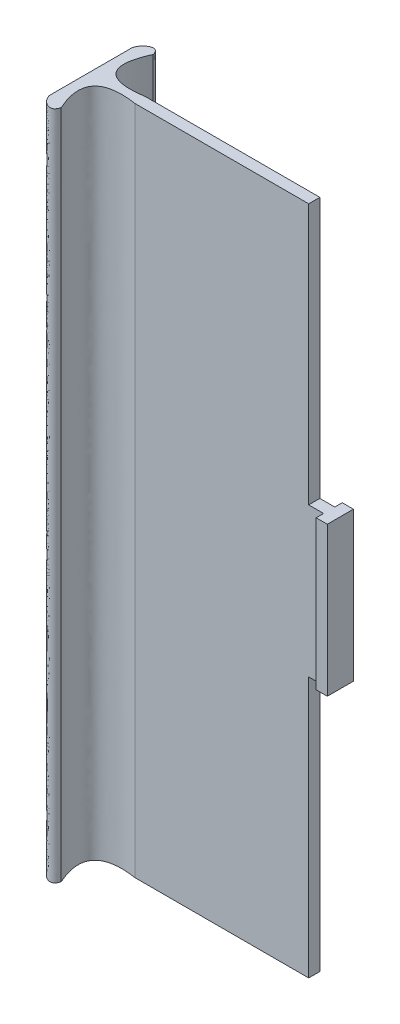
SolidWorks part; units mm, degrees
ref_plane "Front Plane" through (0, 0, 0) normal (0, 0, 1) x (1, 0, 0)
ref_plane "Top Plane" through (0, 0, 0) normal (0, 1, 0) x (1, 0, 0)
ref_plane "Right Plane" through (0, 0, 0) normal (1, 0, 0) x (0, 0, -1)
sketch "Sketch1" plane through (0, 0, 0) normal (0, 1, 0) x (1, 0, 0)
  line L0 (0, 0) -> (0, -3)
  line L1 (0, -1.5) -> (-60, -1.5) construction
  line L2 (-60, -12.043) -> (-60, 9.043)
  line L3 (0, -3) -> (-46.6473, -3)
  line L4 (0, 0) -> (-46.6473, 0)
  spline S0 degree 2 poles (-46.6473, 0) (-61.4881, -2.2557) (-55.5989, 10.8556) knots 0 0 0 1 1 1
  spline S1 degree 3 poles (-55.5989, 10.8556) (-56.3573, 14.2235) (-60.2312, 11.2167) (-60, 9.043) knots 0 0 0 0 1 1 1 1
  spline S2 degree 3 poles (-55.5989, -13.8556) (-56.3573, -17.2235) (-60.2312, -14.2167) (-60, -12.043) knots 0 0 0 0 1 1 1 1
  spline S3 degree 2 poles (-46.6473, -3) (-61.4881, -0.7443) (-55.5989, -13.8556) knots 0 0 0 1 1 1
  point P17 (-56.6355, 1.3857)
  point P18 (-46.6473, 0)
  point P19 (-56.5412, 1.9039)
  point P20 (-54.3269, 10.9499)
  point P21 (-56.9653, 12.3633)
  point P22 (-55.5989, 10.8556)
extrude "Boss-Extrude1" add sketch "Sketch1" along normal blind 180
sketch "Sketch2" plane through (0, 0, 0) normal (0, 0, 1) x (1, 0, 0)
  line L0 (-27.6986, 0) -> (-27.6986, 90) construction
  line L1 (-46.6473, 0) -> (0, 0) construction
ref_plane "Plane1" through (0, 90, 0) normal (0, 1, 0) x (1, 0, 0)
sketch "Sketch3" plane through (0, 90, 0) normal (0, 1, 0) x (1, 0, 0)
  line L0 (4, -3) -> (4, -5)
  line L1 (0, 0) -> (4, 0)
  line L2 (0, 0) -> (0, -3)
  line L3 (0, -3) -> (4, -3)
  line L5 (4, 2) -> (7, 2)
  line L6 (4, 2) -> (4, 0)
  line L7 (4, -5) -> (7, -5)
  line L8 (7, 2) -> (7, -5)
extrude "Boss-Extrude2" add sketch "Sketch3" along normal mid plane 40
equation "\"ExternalDiameterBallBearing\" = 22mm"
equation "\"InternalDiameterBallBearing\"= 8mm"
equation "\"WidthJoints\"= 3mm"
equation "\"Widthblade\"= 3mm"
equation "\"LenghtJoints\"= 7mm"
equation "\"HeightJoints\"= 40mm"
equation "\"DeepnessJoints\"= 60mm"
equation "\"TurbineShaftDiameter\"= 40mm"
equation "\"HeightTurbine\"= 180mm"
equation "\"HeightBase\"= 20mm"
equation "\"HeightBlade\"= 180mm"
equation "\"HeightBallBearing\"= 7mm"
equation "\"HeightBox\"= 40mm"
equation "\"LenghtBlade\"= 60mm"
equation "\"Lsqare\"= 90mm"
equation "\"lenghtJointsForBox\"=30mm"
equation "\"ErrorForJoints1\"=0.6mm"
equation "\"ErrorForJoints2\"=0.4mm"
equation "\"ErrorForJointsBlade\"=1mm"
equation "\"D1@Sketch1\"=\"Widthblade\"/2"
equation "\"D2@Sketch1\"=\"LenghtBlade\""
equation "\"D1@Boss-Extrude1\"=\"HeightBlade\""
equation "\"D1@Sketch2\"=\"HeightBlade\"/2"
equation "\"D1@Sketch3\"=\"LenghtJoints\""
equation "\"D2@Sketch3\"=\"WidthJoints\""
equation "\"D3@Sketch3\"=\"WidthJoints\""
equation "\"D4@Sketch3\"=\"WidthJoints\"+\"ErrorForJointsBlade\""
equation "\"D1@Boss-Extrude2\"=\"HeightJoints\""
